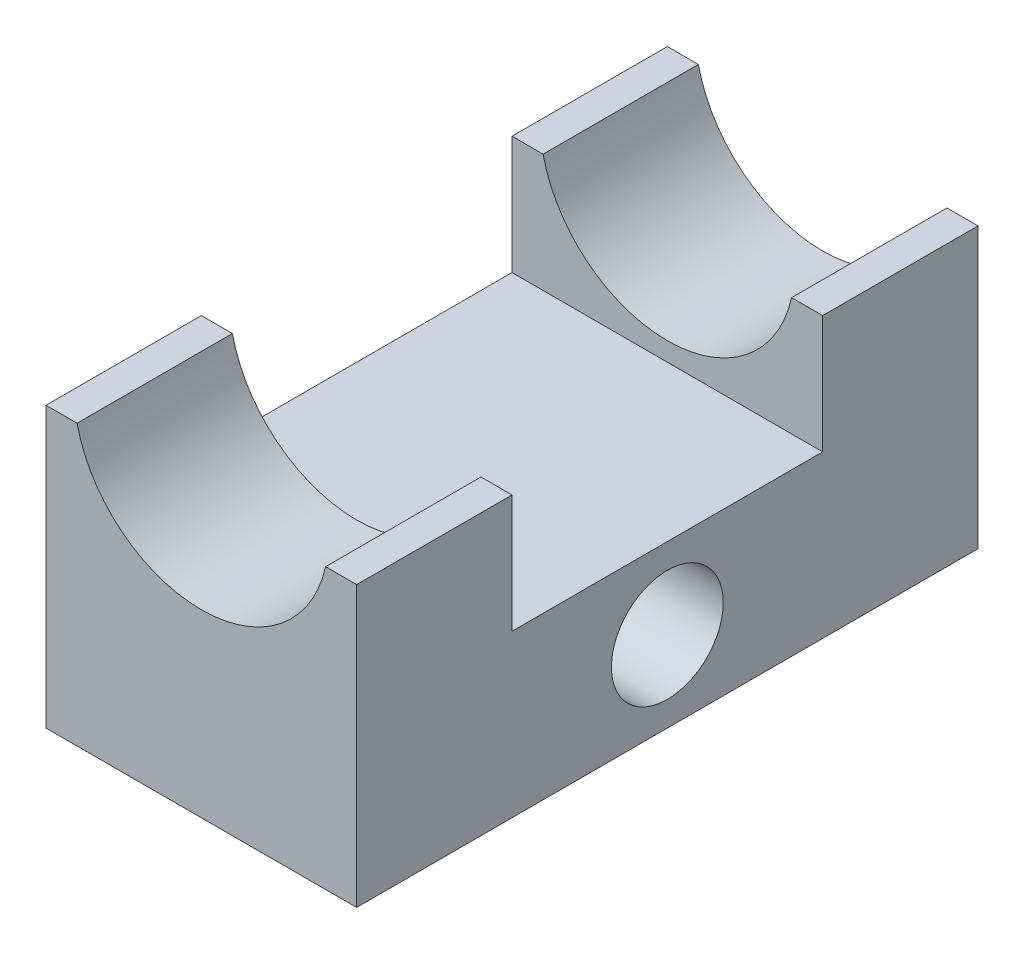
SolidWorks part; units mm, degrees
ref_plane "Plan de face" through (0, 0, 0) normal (0, 0, 1) x (1, 0, 0)
ref_plane "Plan de dessus" through (0, 0, 0) normal (0, 1, 0) x (1, 0, 0)
ref_plane "Plan de droite" through (0, 0, 0) normal (1, 0, 0) x (0, 0, -1)
sketch "Esquisse1" plane through (0, 0, 0) normal (0, 0, 1) x (1, 0, 0)
  line L1 (999.9185, 343.3476) -> (994.9185, 343.3476)
  line L2 (994.9185, 343.3476) -> (994.9185, 298.3476)
  line L3 (994.9185, 298.3476) -> (1044.9185, 298.3476)
  line L4 (1044.9185, 298.3476) -> (1044.9185, 343.3476)
  line L5 (1044.9185, 343.3476) -> (1039.9185, 343.3476)
  arc A0 (999.9185, 343.3476) -> (1039.9185, 343.3476) centre (1019.9185, 347.8476) ccw
  dimension "D1" = 20.5
  dimension "D2" = 5
  dimension "D3" = 5
  dimension "D4" = 45
  dimension "D5" = 50
extrude "Boss.-Extru.1" add sketch "Esquisse1" along normal blind 100
sketch "Esquisse2" plane through (1044.9185, 0, 0) normal (1, 0, 0) x (0, 0, -1)
  line L0 (-100, 343.3476) -> (0, 343.3476) construction
  line L1 (-75, 343.3476) -> (-25, 343.3476)
  line L2 (-75, 343.3476) -> (-75, 324.3476)
  line L3 (-75, 324.3476) -> (-25, 324.3476)
  line L4 (-25, 343.3476) -> (-25, 324.3476)
  line L5 (-100, 298.3476) -> (-100, 343.3476) construction
  line L6 (0, 298.3476) -> (0, 343.3476) construction
  line L7 (-100, 298.3476) -> (0, 298.3476) construction
  dimension "D1" = 25
  dimension "D2" = 25
  dimension "D3" = 26
extrude "Enlèv. mat.-Extru.1" cut sketch "Esquisse2" against normal blind 100
sketch "Esquisse3" plane through (1044.9185, 0, 0) normal (1, 0, 0) x (0, 0, -1)
  line L0 (0, 298.3476) -> (0, 343.3476) construction
  line L1 (-75, 324.3476) -> (-25, 324.3476) construction
  circle A0 centre (-50, 311.3476) radius 9
  point P6 (-50, 324.3476)
  dimension "D1" = 18
  dimension "D2" = 50
  dimension "D3" = 13
extrude "Enlèv. mat.-Extru.2" cut sketch "Esquisse3" against normal blind 100
